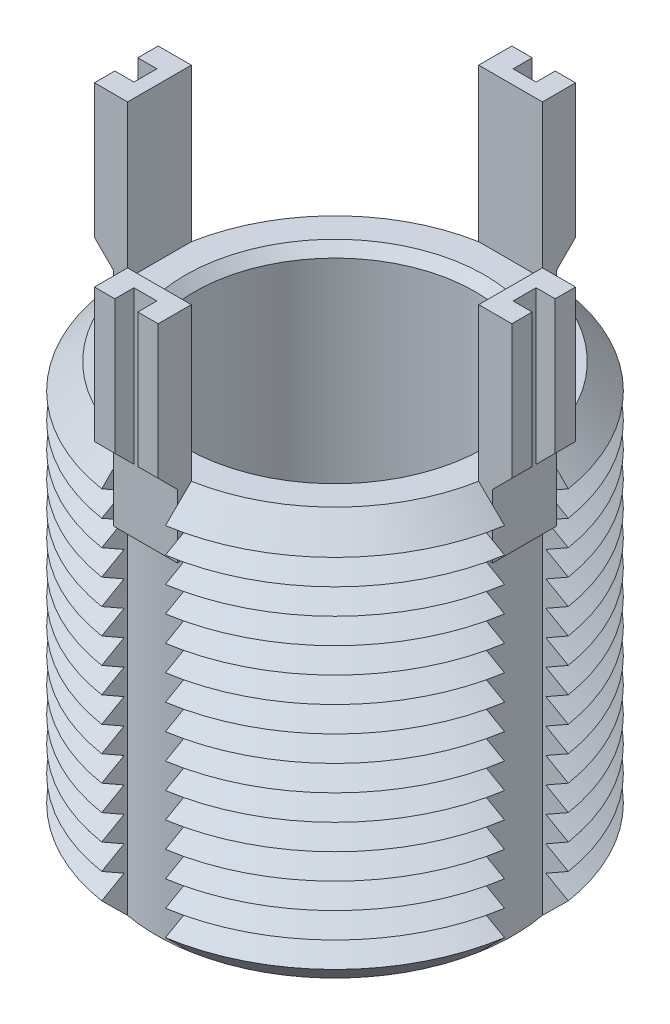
SolidWorks part; units mm, degrees
ref_plane "Front Plane" through (0, 0, 0) normal (0, 0, 1) x (1, 0, 0)
ref_plane "Top Plane" through (0, 0, 0) normal (0, 1, 0) x (1, 0, 0)
ref_plane "Right Plane" through (0, 0, 0) normal (1, 0, 0) x (0, 0, -1)
sketch "Sketch1" plane through (0, 0, 0) normal (0, 1, 0) x (1, 0, 0)
  circle A0 centre (0, 0) radius 16
  dimension "D1" = 32
extrude "Boss-Extrude1" add sketch "Sketch1" against normal blind 32
chamfer "Chamfer1" distance 2 angle 45 2 edges at (0, -32, 16) (0, 0, 16)
sketch "Sketch2" plane through (0, 0, 0) normal (1, 0, 0) x (0, 0, -1)
  line L0 (0, 0.8859) -> (0, -9.2617) construction
sketch "Sketch3" plane through (0, 0, 0) normal (1, 0, 0) x (0, 0, -1)
  line L0 (-16, -2) -> (-14.2679, -3)
  line L1 (-14.2679, -3) -> (-16, -4)
  line L2 (-16, -2) -> (-16, -30) construction
  line L3 (-16, -4) -> (-16, -2)
  dimension "D1" = 2
revolve "Cut-Revolve1" cut sketch "Sketch3" angle 360 about L0
pattern_linear "LPattern1" count 14 spacing 2 along (0, -1, 0) of "Cut-Revolve1"
sketch "Sketch4" plane through (0, 0, 0) normal (0, 1, 0) x (1, 0, 0)
  line L0 (-13.775, 2.5) -> (-15.8035, 2.5)
  line L2 (-15.8035, -2.5) -> (-13.775, -2.5)
  arc A0 (-13.775, 2.5) -> (-13.775, -2.5) centre (0, 0) ccw
  arc A1 (-15.8035, 2.5) -> (-15.8035, -2.5) centre (0, 0) ccw
  circle A2 centre (0, 0) radius 16 construction
  circle A3 centre (0, 0) radius 14 construction
  point P1 (-14, 0)
  point P3 (-16, 0)
  point P13 (0, 0)
  dimension "D1" = 5
extrude "Cut-Extrude1" cut sketch "Sketch4" against normal up to surface (32 mm away)
pattern_circular "CirPattern1" count 4 over 360 about axis through (0, 0, 0) along (0, 1, 0) of "Cut-Extrude1"
sketch "Sketch5" plane through (0, 0, 0) normal (1, 0, 0) x (0, 0, -1)
  line L0 (-13.775, 12) -> (-13.775, -5)
  line L1 (-13.775, -5) -> (-14.875, -5)
  line L2 (-14.875, -5) -> (-14.875, 0)
  line L3 (-14.875, 0) -> (-16.375, 1.5)
  line L4 (-16.375, 1.5) -> (-16.375, 12)
  line L5 (-16.375, 12) -> (-13.775, 12)
  line L6 (-15.8035, -6) -> (-2.5, -6) construction
  point P9 (-2.5, 0)
  point P10 (-14.875, 0)
  dimension "D1" = 1
  dimension "D2" = 17
  dimension "D3" = 12
  dimension "D4" = 2.6
  dimension "D5" = 1.1
  dimension "D6" = 45
extrude "Boss-Extrude3" add sketch "Sketch5" along normal mid plane 5
pattern_circular "CirPattern2" count 4 over 360 about axis through (0, 0, 0) along (0, 1, 0) of "Boss-Extrude3"
sketch "Sketch6" plane through (0, 12, 0) normal (0, 1, 0) x (1, 0, 0)
  line L0 (-16.375, -2.5) -> (-16.375, 2.5) construction
  line L1 (-16.375, -0.9) -> (-14.875, -0.9)
  line L2 (-16.375, -0.9) -> (-16.375, 0.9)
  line L3 (-16.375, 0.9) -> (-14.875, 0.9)
  line L4 (-14.875, -0.9) -> (-14.875, 0.9)
  line L5 (-16.375, -0.9) -> (-14.875, 0.9) construction
  line L6 (-16.375, 0.9) -> (-14.875, -0.9) construction
  line L7 (16.375, 2.5) -> (16.375, -2.5) construction
  line L8 (-0.9, 14.875) -> (0.9, 14.875)
  line L9 (-0.9, 14.875) -> (-0.9, 16.375)
  line L10 (-0.9, 16.375) -> (0.9, 16.375)
  line L11 (0.9, 14.875) -> (0.9, 16.375)
  line L12 (-0.9, 14.875) -> (0.9, 16.375) construction
  line L13 (-0.9, 16.375) -> (0.9, 14.875) construction
  line L14 (14.875, -0.9) -> (16.375, -0.9)
  line L15 (14.875, -0.9) -> (14.875, 0.9)
  line L16 (14.875, 0.9) -> (16.375, 0.9)
  line L17 (16.375, -0.9) -> (16.375, 0.9)
  line L18 (14.875, -0.9) -> (16.375, 0.9) construction
  line L19 (14.875, 0.9) -> (16.375, -0.9) construction
  line L20 (-0.9, -16.375) -> (0.9, -16.375)
  line L21 (-0.9, -16.375) -> (-0.9, -14.875)
  line L22 (-0.9, -14.875) -> (0.9, -14.875)
  line L23 (0.9, -16.375) -> (0.9, -14.875)
  line L24 (-0.9, -16.375) -> (0.9, -14.875) construction
  line L25 (-0.9, -14.875) -> (0.9, -16.375) construction
  line L26 (-2.5, 16.375) -> (2.5, 16.375) construction
  line L27 (2.5, -16.375) -> (-2.5, -16.375) construction
  point P0 (-15.625, 0)
  point P7 (-16.375, 0)
  point P8 (-16.375, 0)
  point P9 (0, 15.625)
  point P14 (15.625, 0)
  point P19 (0, -15.625)
  point P24 (0, 16.375)
  point P25 (16.375, 0)
  point P26 (16.375, 0)
  point P27 (0, 16.375)
  point P30 (0, -16.375)
  point P33 (0, -16.375)
  dimension "D1" = 1.8
  dimension "D2" = 1.5
extrude "Cut-Extrude3" cut sketch "Sketch6" against normal through all both and the other way through all
sketch "Sketch7" plane through (0, 0, 0) normal (0, 1, 0) x (1, 0, 0)
  circle A0 centre (0, 0) radius 11
  dimension "D1" = 22
extrude "Cut-Extrude4" cut sketch "Sketch7" against normal up to surface (32 mm away)
chamfer "Chamfer2" distance 0.75 angle 45 2 edges at (0, 0, 11) (0, -32, 11)
